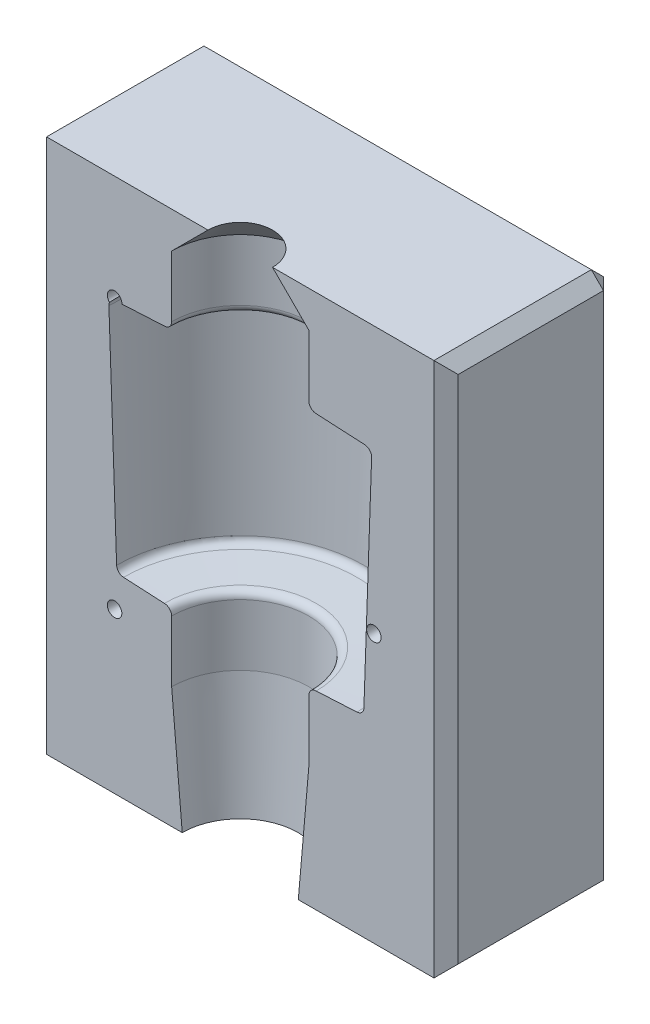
SolidWorks part; units mm, degrees
ref_plane "Plan de face" through (0, 0, 0) normal (0, 0, 1) x (1, 0, 0)
ref_plane "Plan de dessus" through (0, 0, 0) normal (0, 1, 0) x (1, 0, 0)
ref_plane "Plan de droite" through (0, 0, 0) normal (1, 0, 0) x (0, 0, -1)
sketch "Esquisse1" plane through (0, 0, 0) normal (0, 0, 1) x (1, 0, 0)
  line L6 (-80, 92.9352) -> (80, 92.9352) construction
  line L7 (-85, 92.9352) -> (85, 92.9352)
  line L8 (-85, 92.9352) -> (-85, -127.9352)
  line L9 (-85, -127.9352) -> (85, -127.9352)
  line L10 (85, 92.9352) -> (85, -127.9352)
  line L11 (-85, -122.9352) -> (-85, 87.9352) construction
  line L12 (80, -127.9352) -> (-80, -127.9352) construction
  line L13 (85, 87.9352) -> (85, -122.9352) construction
extrude "Extrusion1" add sketch "Esquisse1" against normal blind 70
other "Empreinte1"
other "noyau_intérieur<3>@moyeu de roue"
other "boîte_à_noyau_intérieur_DO<2>@moyeu de roue"
chamfer "Chanfrein1" distance 5 angle 45 10 edges at (0, -127.9352, -70) (85, -17.5, -70) (-85, -17.5, 0) (-85, -127.9352, -35) (-85, -17.5, -70) (0, 92.9352, -70) (85, -127.9352, -35) (85, -17.5, 0) (85, 92.9352, -35) (-85, 92.9352, -35)
